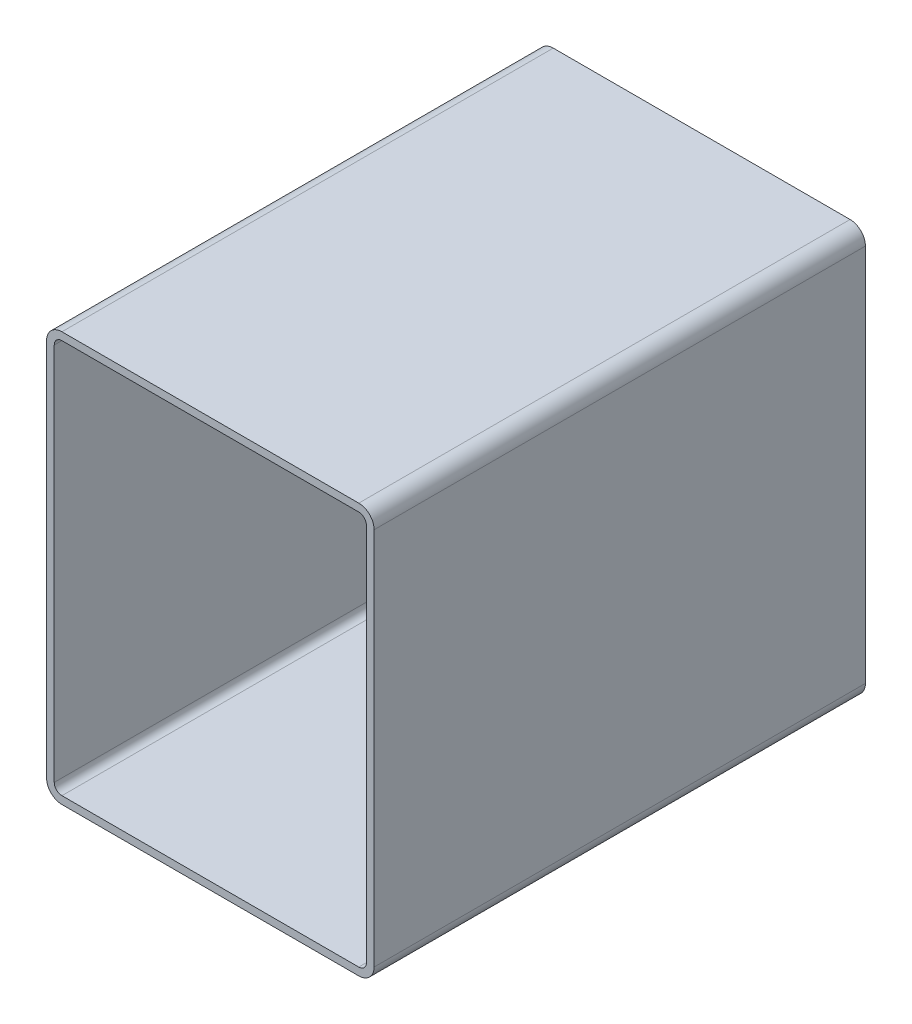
SolidWorks part; units mm, degrees
ref_plane "Front Plane" through (0, 0, 0) normal (0, 0, 1) x (1, 0, 0)
ref_plane "Top Plane" through (0, 0, 0) normal (0, 1, 0) x (1, 0, 0)
ref_plane "Right Plane" through (0, 0, 0) normal (1, 0, 0) x (0, 0, -1)
sketch "Sketch1" plane through (0, 0, 0) normal (0, 0, 1) x (1, 0, 0)
sketch_block_instance "HSS10x8x0.1875-1"
sketch_block "HSS10x8x0.1875"
extrude "Boss-Extrude1" add sketch "Sketch1" along normal blind 304.8
